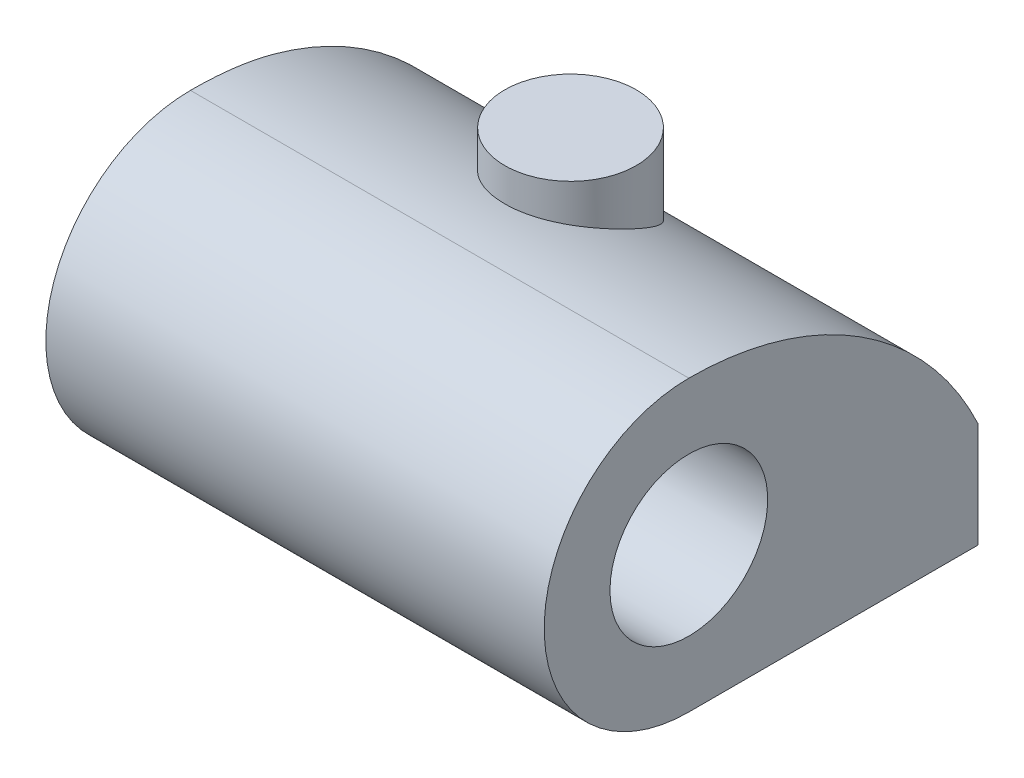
SolidWorks part; units mm, degrees
ref_plane "Front Plane" through (0, 0, 0) normal (0, 0, 1) x (1, 0, 0)
ref_plane "Top Plane" through (0, 0, 0) normal (0, 1, 0) x (1, 0, 0)
ref_plane "Right Plane" through (0, 0, 0) normal (1, 0, 0) x (0, 0, -1)
sketch "Sketch1" plane through (0, 0, 0) normal (1, 0, 0) x (0, 0, -1)
  line L0 (0, -6.985) -> (13.97, -6.985)
  line L1 (13.97, -6.985) -> (13.97, -1.905)
  circle A0 centre (0, 0) radius 3.81
  arc A1 (0, 6.985) -> (0, -6.985) centre (0, 0) ccw
  arc A2 (0, 6.985) -> (13.97, -1.905) centre (0, -8.4364) cw
  dimension "D1" = 13.97
  dimension "D2" = 7.62
  dimension "D4" = 5.08
  dimension "D6" = 13.97
extrude "Boss-Extrude1" add sketch "Sketch1" along normal blind 24.13
fillet "Fillet1" radius 3.81 1 edges at (0, 0, -3.81)
sketch "Sketch2" plane through (0, -6.985, 0) normal (0, -1, 0) x (-1, 0, 0)
  line L0 (-24.13, 13.97) -> (0, 13.97) construction
  circle A0 centre (-12.065, 6.35) radius 3.175
  point P4 (-12.065, 13.97)
  dimension "D1" = 6.35
  dimension "D2" = 7.62
extrude "Boss-Extrude2" add sketch "Sketch2" against normal blind 15.24
sketch "Sketch3" plane through (0, 0, 0) normal (-1, 0, 0) x (0, 0, 1)
  circle A0 centre (0, 0) radius 3.81
  circle A1 centre (0, 0) radius 3.81 construction
extrude "Cut-Extrude1" cut sketch "Sketch3" against normal blind 25.4
